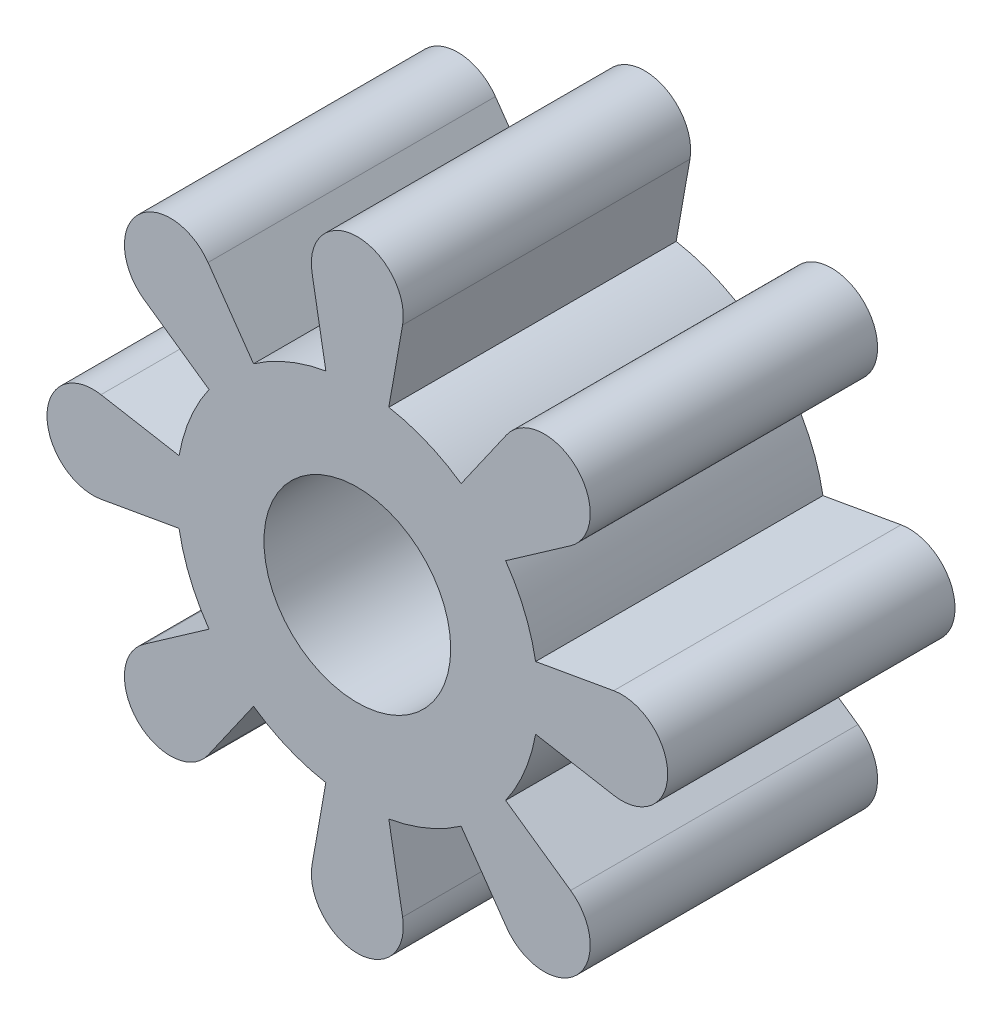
SolidWorks part; units mm, degrees
ref_plane "Спереди" through (0, 0, 0) normal (0, 0, 1) x (1, 0, 0)
ref_plane "Сверху" through (0, 0, 0) normal (0, 1, 0) x (1, 0, 0)
ref_plane "Справа" through (0, 0, 0) normal (1, 0, 0) x (0, 0, -1)
sketch "Эскиз1" plane through (0, 0, 0) normal (0, 0, 1) x (1, 0, 0)
  line L0 (0, 17.1708) -> (0, 0) construction
  line L1 (0, 0) -> (16.5146, 0) construction
  line L2 (-1.0957, 6.204) -> (-1.5756, 8.9217)
  line L3 (1.0957, 6.204) -> (1.5756, 8.9217)
  line L4 (3.6121, 5.1616) -> (5.1945, 7.4228)
  line L5 (5.1616, 3.6121) -> (7.4228, 5.1945)
  line L6 (6.204, 1.0957) -> (8.9217, 1.5756)
  line L7 (6.204, -1.0957) -> (8.9217, -1.5756)
  line L8 (5.1616, -3.6121) -> (7.4228, -5.1945)
  line L9 (3.6121, -5.1616) -> (5.1945, -7.4228)
  line L10 (1.0957, -6.204) -> (1.5756, -8.9217)
  line L11 (-1.0957, -6.204) -> (-1.5756, -8.9217)
  line L12 (-3.6121, -5.1616) -> (-5.1945, -7.4228)
  line L13 (-5.1616, -3.6121) -> (-7.4228, -5.1945)
  line L14 (-6.204, -1.0957) -> (-8.9217, -1.5756)
  line L15 (-6.204, 1.0957) -> (-8.9217, 1.5756)
  line L16 (-5.1616, 3.6121) -> (-7.4228, 5.1945)
  line L17 (-3.6121, 5.1616) -> (-5.1945, 7.4228)
  circle A0 centre (0, 0) radius 3.25
  circle A1 centre (0, 0) radius 10.8 construction
  arc A2 (-1.0957, 6.204) -> (-3.6121, 5.1616) centre (0, 0) ccw
  arc A3 (1.5756, 8.9217) -> (-1.5756, 8.9217) centre (0, 9.2) ccw
  circle A4 centre (0, 0) radius 9.2 construction
  arc A5 (7.4228, 5.1945) -> (5.1945, 7.4228) centre (6.5054, 6.5054) ccw
  arc A6 (8.9217, -1.5756) -> (8.9217, 1.5756) centre (9.2, 0) ccw
  arc A7 (5.1945, -7.4228) -> (7.4228, -5.1945) centre (6.5054, -6.5054) ccw
  arc A8 (-1.5756, -8.9217) -> (1.5756, -8.9217) centre (0, -9.2) ccw
  arc A9 (-7.4228, -5.1945) -> (-5.1945, -7.4228) centre (-6.5054, -6.5054) ccw
  arc A10 (-8.9217, 1.5756) -> (-8.9217, -1.5756) centre (-9.2, 0) ccw
  arc A11 (-5.1945, 7.4228) -> (-7.4228, 5.1945) centre (-6.5054, 6.5054) ccw
  arc A12 (-5.1616, 3.6121) -> (-6.204, 1.0957) centre (0, 0) ccw
  arc A13 (-6.204, -1.0957) -> (-5.1616, -3.6121) centre (0, 0) ccw
  arc A14 (-3.6121, -5.1616) -> (-1.0957, -6.204) centre (0, 0) ccw
  arc A15 (1.0957, -6.204) -> (3.6121, -5.1616) centre (0, 0) ccw
  arc A16 (5.1616, -3.6121) -> (6.204, -1.0957) centre (0, 0) ccw
  arc A17 (6.204, 1.0957) -> (5.1616, 3.6121) centre (0, 0) ccw
  arc A18 (3.6121, 5.1616) -> (1.0957, 6.204) centre (0, 0) ccw
  point P6 (-19.8294, 1.7255)
  dimension "D1" = 6.5
  dimension "D2" = 21.6
  dimension "D3" = 12.6
  dimension "D4" = 3.2
  dimension "D5" = 18.4
  dimension "D6" = 8
extrude "Бобышка-Вытянуть1" add sketch "Эскиз1" along normal blind 10
